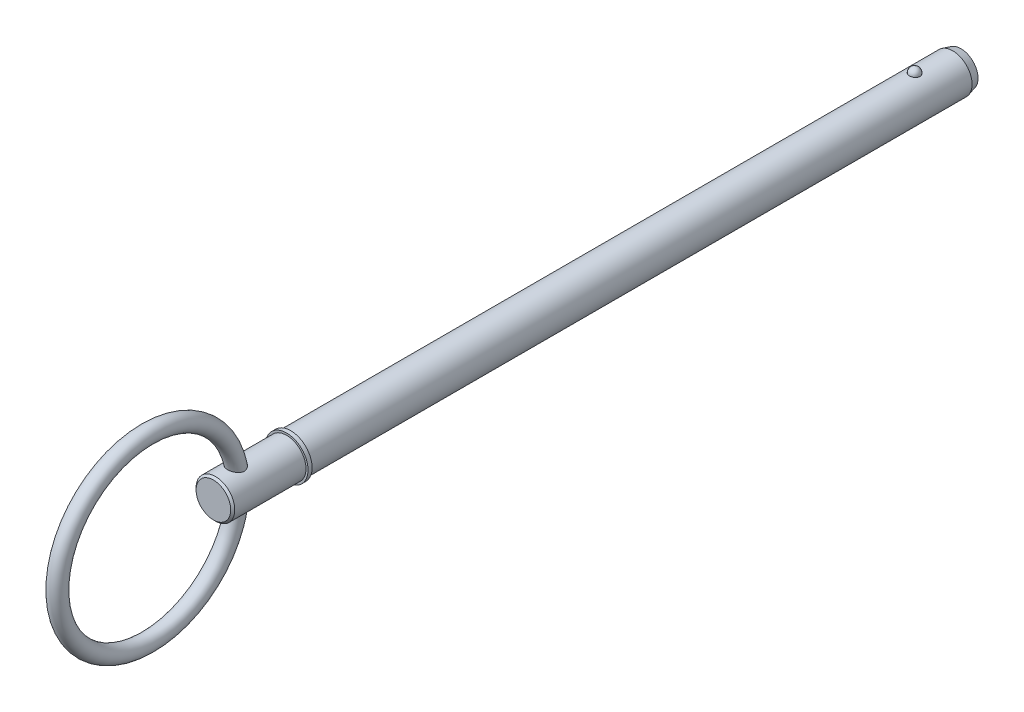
SolidWorks part; units mm, degrees
ref_plane "Front Plane" through (0, 0, 0) normal (0, 0, 1) x (1, 0, 0)
ref_plane "Top Plane" through (0, 0, 0) normal (0, 1, 0) x (1, 0, 0)
ref_plane "Right Plane" through (0, 0, 0) normal (1, 0, 0) x (0, 0, -1)
sketch "Sketch2" plane through (0, 0, 0) normal (0, 0, 1) x (1, 0, 0)
  circle A0 centre (0, 0) radius 4.765
  point P3 (0, 4.765)
  dimension "D1" = 9.53
extrude "Boss-Extrude1" add sketch "Sketch2" along normal blind 152.4
sketch "Sketch3" plane through (0, 0, 0) normal (0, 0, -1) x (-1, 0, 0)
  circle A0 centre (0, 0) radius 4.765
  dimension "D1" = 9.53
extrude "Boss-Extrude2" add sketch "Sketch3" along normal blind 12.7
chamfer "Chamfer1" distance 2 angle 15 1 edges at (-4.765, 0, -12.7)
sketch "Sketch18" plane through (0, 0, 0) normal (1, 0, 0) x (0, 0, -1)
  line L0 (10.7, 4.765) -> (-152.4, 4.765) construction
  line L1 (1.29, 6.055) -> (1.29, 3.475)
  line L2 (-152.4, -4.765) -> (10.7, -4.765) construction
  arc A0 (1.29, 6.055) -> (1.29, 3.475) centre (1.29, 4.765) ccw
  point P4 (0, 4.765)
  dimension "D1" = 10.82
revolve "Revolve1" add sketch "Sketch18" angle 360 about L1
sketch "Sketch19" plane through (0, 0, 0) normal (1, 0, 0) x (0, 0, -1)
  line L0 (-33.7288, 0) -> (-46.4542, 0) construction
sketch "Sketch20" plane through (0, 0, 0) normal (1, 0, 0) x (0, 0, -1)
  line L0 (-152.4, 0) -> (-152.4, 5.265)
  line L1 (-152.4, 4.765) -> (-152.4, -4.765) construction
  line L2 (-152.4, 5.265) -> (-153.4, 5.265)
  line L3 (-153.4, 5.265) -> (-153.4, 0)
  line L4 (-33.7288, 0) -> (-46.4542, 0) construction
  line L5 (-153.4, 0) -> (-152.4, 0)
  dimension "D1" = 5.265
  dimension "D2" = 1
revolve "Revolve2" add sketch "Sketch20" angle 360 about L0
sketch "Sketch21" plane through (0, 0, 152.4) normal (0, 0, -1) x (-1, 0, 0)
  circle A0 centre (0, 0) radius 4.765
  dimension "D1" = 9.53
extrude "Boss-Extrude3" add sketch "Sketch21" against normal blind 19.05
chamfer "Chamfer2" distance 0.5 angle 45 1 edges at (-4.765, 0, 171.45)
sketch "Sketch23" plane through (0, 0, 0) normal (1, 0, 0) x (0, 0, -1)
  line L0 (-171.45, 4.265) -> (-171.45, -4.265) construction
  circle A0 centre (-187.675, 0) radius 22.225
  point P2 (-165.45, 0)
  dimension "D1" = 44.45
  dimension "D2" = 6
sketch "Sketch24" plane through (0, 0, 0) normal (0, 1, 0) x (1, 0, 0)
  circle A0 centre (0, -165.45) radius 2
  dimension "D1" = 4
sweep "Sweep1" add profiles "Sketch24" path "Sketch23"
